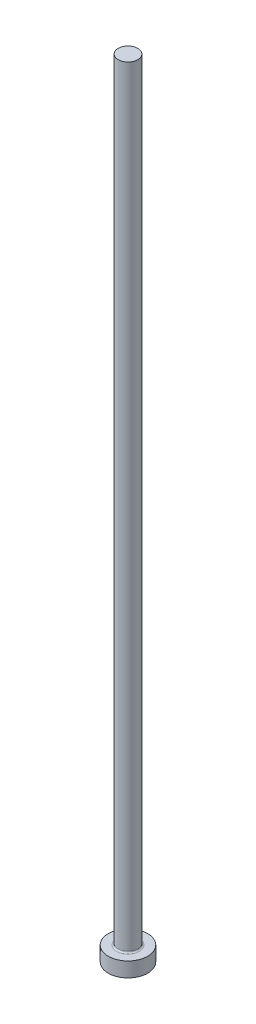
SolidWorks part; units mm, degrees
ref_plane "Plano frontal" through (0, 0, 0) normal (0, 0, 1) x (1, 0, 0)
ref_plane "Plano superior" through (0, 0, 0) normal (0, 1, 0) x (1, 0, 0)
ref_plane "Plano direito" through (0, 0, 0) normal (1, 0, 0) x (0, 0, -1)
sketch "Esboço1" plane through (0, 0, 0) normal (0, 0, 1) x (1, 0, 0)
  line L0 (0, 0) -> (4, 0)
  line L1 (4, 0) -> (4, 3)
  line L2 (4, 3) -> (2.3, 3)
  line L3 (2, 3.3) -> (2, 160)
  line L4 (2, 160) -> (0, 160)
  line L5 (0, 160) -> (0, 0) construction
  line L6 (0, 0) -> (0, 160)
  arc A0 (2.3, 3) -> (2, 3.3) centre (2.3, 3.3) cw
  dimension "D3" = 0.3
  dimension "D1" = 8
  dimension "D2" = 4
  dimension "D4" = 3
  dimension "D5" = 160
revolve "Revolução1" add sketch "Esboço1" angle 360 about L5
sketch "Esboço2"
  dimension "D1" = 0.45
  dimension "D2" = 0.7
  dimension "D3" = 0.3
  dimension "D4" = 2.15
wrap "Envolver1" sketch "Esboço2" wrap type deboss source sketch "Esboço2" thickness 0.1 parameters "D1"=0.1
